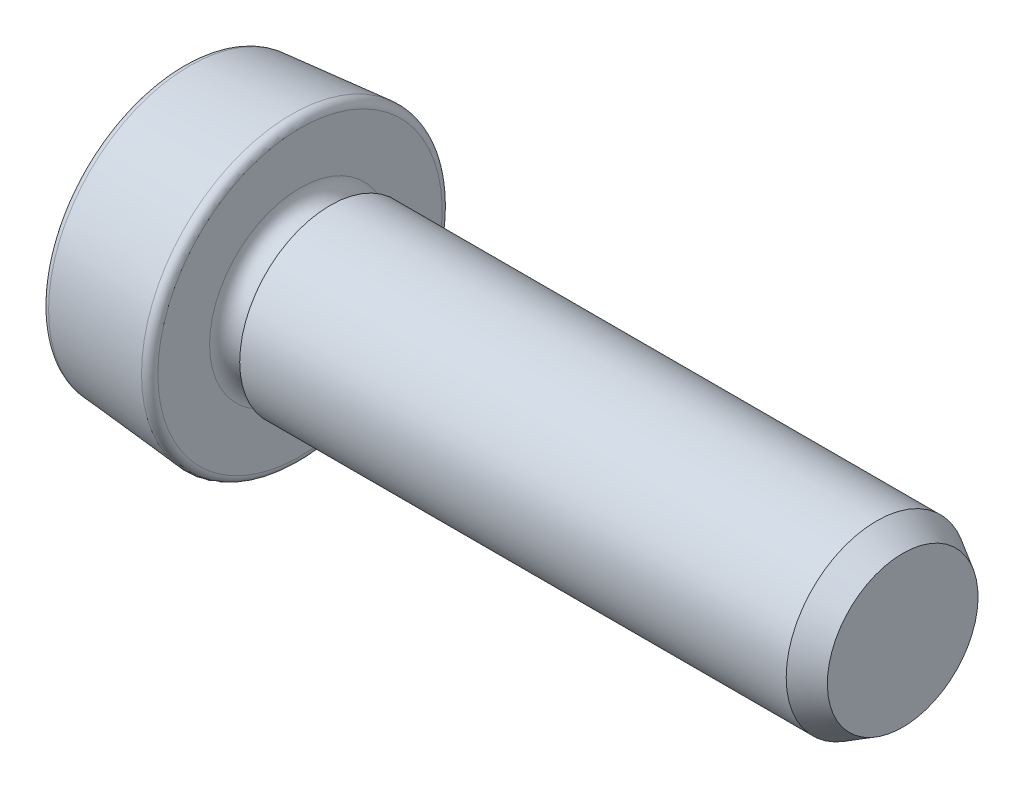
SolidWorks part; units mm, degrees
ref_plane "Front" through (0, 0, 0) normal (0, 0, 1) x (1, 0, 0)
ref_plane "Top" through (0, 0, 0) normal (0, 1, 0) x (1, 0, 0)
ref_plane "Right" through (0, 0, 0) normal (1, 0, 0) x (0, 0, -1)
sketch "Sketch1" plane through (0, 0, 0) normal (0, 0, 1) x (1, 0, 0)
  line L0 (-46.2686, 0) -> (11.3165, 0) construction
  line L1 (23.9, 0) -> (23.9, 3)
  line L2 (23.9, 3) -> (3.9, 3)
  line L3 (3.9, 3) -> (3.9, 5)
  line L4 (3.9, 5) -> (0, 4.6588)
  line L5 (0, 4.6588) -> (0, 0)
  line L6 (23.9, 0) -> (0, 0)
  dimension "d" = 6
  dimension "D3" = 5
  dimension "k" = 3.9
  dimension "l" = 20
  dimension "dk" = 10
revolve "Base" add sketch "Sketch1" angle 360 about L0
sketch "Sketch6" plane through (0, 0, 0) normal (1, 0, 0) x (0, 0, -1)
  line L1 (0, 2.075) -> (-1.797, 1.0375)
  line L2 (-1.797, 1.0375) -> (-1.797, -1.0375)
  line L3 (-1.797, -1.0375) -> (0, -2.075)
  line L4 (0, -2.075) -> (1.797, -1.0375)
  line L5 (1.797, -1.0375) -> (1.797, 1.0375)
  line L6 (1.797, 1.0375) -> (0, 2.075)
  circle A0 centre (0, 0) radius 2.075 construction
  dimension "s" = 4.15
extrude "Socket" cut sketch "Sketch6" along normal blind 2
ref_plane "Plane1" through (3, 0, 0) normal (-1, 0, 0) x (0, 0, 1)
sketch "Sketch8" plane through (3, 0, 0) normal (-1, 0, 0) x (0, 0, 1)
  point P0 (0, 0)
sketch "Sketch9" plane through (2, 0, 0) normal (-1, 0, 0) x (0, 0, 1)
  line L6 (0, 2.075) -> (-1.797, 1.0375)
  line L7 (-1.797, 1.0375) -> (-1.797, -1.0375)
  line L8 (-1.797, -1.0375) -> (0, -2.075)
  line L9 (0, -2.075) -> (1.797, -1.0375)
  line L10 (1.797, -1.0375) -> (1.797, 1.0375)
  line L11 (1.797, 1.0375) -> (0, 2.075)
  line L12 (0, 2.075) -> (-1.797, 1.0375)
  line L13 (-1.797, 1.0375) -> (-1.797, -1.0375)
  line L14 (-1.797, -1.0375) -> (0, -2.075)
  line L15 (0, -2.075) -> (1.797, -1.0375)
  line L16 (1.797, -1.0375) -> (1.797, 1.0375)
  line L17 (1.797, 1.0375) -> (0, 2.075)
  dimension "D1" = 0
loft "Cut-Loft1" cut profiles "Sketch9", "Sketch8"
fillet "Fillet1" radius 0.26 2 edges at (3.9, 0, 5) (0, 0, 4.6588)
sketch "Sketch5" plane through (0, 0, 0) normal (0, 0, 1) x (1, 0, 0)
  line L0 (25.2282, 0) -> (0, 0) construction
  line L1 (23.9, -3) -> (23.9, 3) construction
  line L2 (23.034, -3) -> (23.9, -2.5)
  line L6 (23.9, -2.5) -> (23.9, -3)
  line L7 (23.9, -3) -> (23.034, -3)
  dimension "D1" = 30
  dimension "D2" = 5
  dimension "D3" = 6
revolve "Cut-Revolve1" cut sketch "Sketch5" angle 360 about L0
sketch "Sketch3" plane through (0, 0, 0) normal (0, 0, 1) x (1, 0, 0)
  line L0 (-13.8866, 0) -> (-33.7599, 0) construction
  line L1 (0, 0) -> (8.6239, 0) construction
  line L2 (3.9, 3) -> (4.9, 3)
  line L4 (3.9, -5) -> (3.9, 5) construction
  arc A0 (4.9, 3) -> (3.9, 3) centre (4.4, 3) cw
  dimension "D1" = 6
  dimension "a" = 1
revolve "Cut-Revolve2" cut sketch "Sketch3" angle 360 about L0
sketch "Sketch10" plane through (0, 0, 0) normal (0, 0, 1) x (1, 0, 0)
  line L0 (22.7453, 3.5774) -> (23.3226, 3.5774)
  line L1 (23.3226, 3.5774) -> (23.3226, 3)
  line L2 (23.3226, 3) -> (23.034, 2.5)
  line L3 (23.034, 2.5) -> (22.7453, 3)
  line L4 (22.7453, 3) -> (22.7453, 3.5774)
  line L5 (0, 0) -> (25.3203, 0) construction
  line L6 (23.034, 3) -> (23.034, -3) construction
  dimension "D1" = 5
  dimension "D2" = 6
revolve "Cut-Revolve10" [suppressed] cut sketch "Sketch10" angle 360 about L5
pattern_linear "LPattern10" [suppressed] count 26 spacing 0.75 along (1, 0, 0)
sketch "Sketch4" plane through (0, 0, 0) normal (0, 0, 1) x (1, 0, 0)
  line L0 (7.6957, 0) -> (-6.5597, 0) construction
  line L1 (8.9857, 3) -> (8.9857, 4)
  line L2 (3.9, 4) -> (3.9, 2.5)
  line L3 (8.9857, 4) -> (3.9, 4)
  line L4 (0, 0) -> (0, 2.5) construction
  line L5 (3.9, 2.5) -> (7.7357, 2.5)
  line L6 (7.7357, 2.5) -> (8.9857, 3)
  line L7 (3.9, -4.7163) -> (3.9, 4.7163) construction
  line L10 (23.9, -3) -> (23.9, 3) construction
  dimension "D3" = 1.25
  dimension "D1" = 5
  dimension "D2" = 1
  dimension "x" = 2.5
  dimension "b" = 14.9143
  dimension "D4" = 6
revolve "Cut-Revolve3" [suppressed] cut sketch "Sketch4" angle 360 about L0
equation "\"D2@ThreadCosmetic1\" = \"d@Sketch1\" - 1"
equation "\"D2@Sketch5\" = \"D2@ThreadCosmetic1\""
equation "\"D3@Sketch5\" = \"d@Sketch1\""
equation "\"D1@Sketch3\" = \"d@Sketch1\""
equation "\"D1@Plane1\" = \"t@Socket\" / 2"
equation "\"D1@Fillet1\" = \"k@Sketch1\" / 15"
equation "\"D1@Sketch10\" = \"D2@ThreadCosmetic1\""
equation "\"D2@Sketch10\" = \"d@Sketch1\""
equation "\"D3@LPattern10\" = (  \"D2@Sketch10\" - \"D1@Sketch10\" )  / 2 * 1.5"
equation "\"D1@LPattern10\" = (  \"l@Sketch1\" - (  \"D3@Sketch5\" - \"D2@Sketch5\" )  / 2 * 1.732 )  / \"D3@LPattern10\""
equation "\"D3@Sketch4\" = \"x@Sketch4\"  / 2"
equation "\"D1@Sketch4\" = \"D2@ThreadCosmetic1\""
equation "\"D4@Sketch4\" = \"d@Sketch1\""
